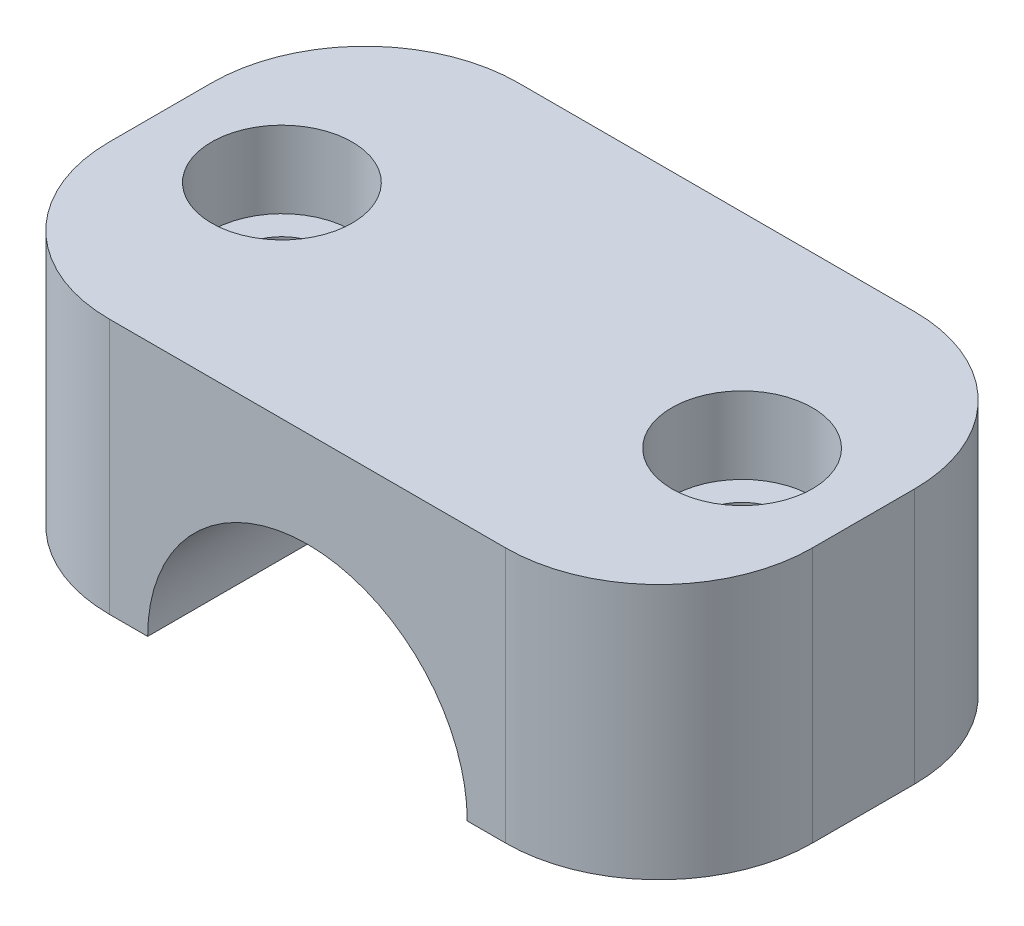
SolidWorks part; units mm, degrees
ref_plane "Front Plane" through (0, 0, 0) normal (0, 0, 1) x (1, 0, 0)
ref_plane "Top Plane" through (0, 0, 0) normal (0, 1, 0) x (1, 0, 0)
ref_plane "Right Plane" through (0, 0, 0) normal (1, 0, 0) x (0, 0, -1)
sketch "Sketch1" plane through (0, 0, 0) normal (0, 0, 1) x (1, 0, 0)
  line L1 (-27.5, 0) -> (27.5, 0)
  line L2 (-27.5, 0) -> (-27.5, 20)
  line L3 (-27.5, 20) -> (27.5, 20)
  line L4 (27.5, 0) -> (27.5, 20)
  dimension "D1" = 55
  dimension "D2" = 20
extrude "Boss-Extrude1" add sketch "Sketch1" along normal mid plane 32
sketch "Sketch2" plane through (0, 0, 16) normal (0, 0, 1) x (1, 0, 0)
  line L0 (-27.5, 0) -> (27.5, 0) construction
  circle A0 centre (0, 0) radius 12.5
  dimension "D1" = 25
extrude "Cut-Extrude1" cut sketch "Sketch2" against normal through all
fillet "Fillet1" radius 12 4 edges at (-27.5, 10, -16) (27.5, 10, -16) (27.5, 10, 16) (-27.5, 10, 16)
hole_wizard "CBORE for M6 SHCS2" positions "Sketch6" profile "Sketch5" counterbore size "M6" standard "ANSI Metric"
sketch "Sketch6" plane through (0, 20, 0) normal (0, 1, 0) x (1, 0, 0)
  point P0 (-18, 0)
  dimension "D1" = 18
sketch "Sketch5" plane through (-18, 20, 0) normal (1, 0, 0) x (0, 0, 1)
  line L0 (0, 0) -> (0, 20)
  line L1 (0, 20) -> (3.3, 20)
  line L3 (3.3, 20) -> (3.3, 6)
  line L4 (3.3, 6) -> (5.5, 6)
  line L5 (5.5, 6) -> (5.5, 0)
  line L7 (5.5, 0) -> (0, 0)
  line L11 (0, -6.35) -> (0, 107.95) construction
  dimension "Thru Hole Dia." = 6.6
  dimension "Thru Hole Depth" = 20
  dimension "C'Bore Dia." = 11
  dimension "C'Bore Depth" = 6
mirror "Mirror1" about plane through (0, 0, 0) normal (1, 0, 0) of "CBORE for M6 SHCS2"
